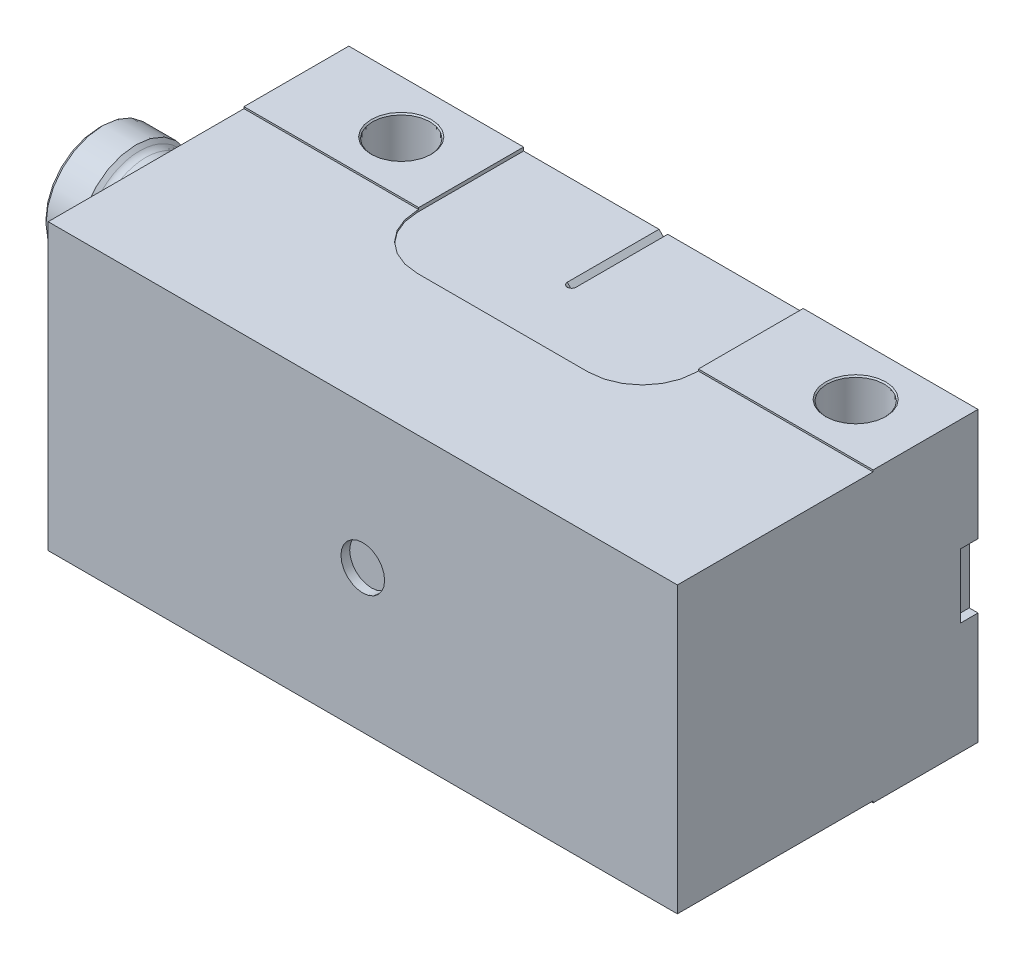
SolidWorks part; units mm, degrees
ref_plane "Front Plane" through (0, 0, 0) normal (0, 0, 1) x (1, 0, 0)
ref_plane "Top Plane" through (0, 0, 0) normal (0, 1, 0) x (1, 0, 0)
ref_plane "Right Plane" through (0, 0, 0) normal (1, 0, 0) x (0, 0, -1)
imported_body "Imported3"
sketch "Sketch1" plane through (0, 0, 6.0501) normal (0, 0, -1) x (-1, 0, 0)
  line L0 (-0.2501, 8.05) -> (-0.0001, 7.8)
  line L1 (-0.0001, 7.8) -> (0.2501, 8.05)
  line L2 (0.2501, 8.05) -> (0.2501, -8.05)
  line L3 (0.2501, -8.05) -> (0.0001, -7.8)
  line L4 (0.0001, -7.8) -> (-0.2501, -8.05)
  line L5 (-0.2501, -8.05) -> (-0.2501, 8.05)
extrude "Boss-Extrude1" add sketch "Sketch1" along normal blind 5.2501
sketch "Sketch2" plane through (0, 0, 6.3001) normal (0, 0, 1) x (1, 0, 0)
  line L0 (0.2501, -8.05) -> (-0.2501, -8.05)
  line L1 (-0.2501, -8.05) -> (-0.2501, 8.05)
  line L2 (-0.2501, 8.05) -> (0.2501, 8.05)
  line L3 (0.2501, 8.05) -> (0.2501, -8.05)
extrude "Boss-Extrude2" add sketch "Sketch2" along normal blind 0.4999
sketch "Sketch3" plane through (0.2501, 0, 0) normal (1, 0, 0) x (0, 0, -1)
  line L0 (-6.8, 8.05) -> (-0.8, 8.05)
  line L1 (-0.8, 8.05) -> (-0.8, -8.05)
  line L2 (-0.8, -8.05) -> (-6.8, -8.05)
  line L3 (-6.8, -8.05) -> (-6.8, 8.05)
extrude "Boss-Extrude3" add sketch "Sketch3" along normal blind 17.7499
sketch "Sketch4" plane through (-0.2501, 0, 0) normal (-1, 0, 0) x (0, 0, 1)
  line L0 (6.8, -8.05) -> (0.8, -8.05)
  line L1 (0.8, -8.05) -> (0.8, 8.05)
  line L2 (0.8, 8.05) -> (6.8, 8.05)
  line L3 (6.8, 8.05) -> (6.8, -8.05)
extrude "Boss-Extrude4" add sketch "Sketch4" along normal blind 17.7499
sketch "Sketch5" plane through (0, 0, 6.8) normal (0, 0, 1) x (1, 0, 0)
  line L0 (18, -8.15) -> (-18, -8.15)
  line L1 (-18, -8.15) -> (-18, 8.15)
  line L2 (-18, 8.15) -> (18, 8.15)
  line L3 (18, 8.15) -> (18, -8.15)
extrude "Boss-Extrude5" add sketch "Sketch5" along normal blind 11.2
sketch "Sketch6" plane through (0, 8.15, 0) normal (0, 1, 0) x (-1, 0, 0)
  line L0 (8, 10) -> (-8, 10)
  line L1 (-8, 10) -> (-8, 6.8)
  line L2 (-8, 6.8) -> (8, 6.8)
  line L3 (8, 6.8) -> (8, 10)
extrude "Cut-Extrude1" cut sketch "Sketch6" against normal blind 0.1
sketch "Sketch7" plane through (0, 8.05, 0) normal (0, 1, 0) x (-1, 0, 0)
  line L0 (-8, 6.8) -> (-8, 0.8)
  line L1 (-8, 0.8) -> (-18, 0.8)
  line L2 (-18, 0.8) -> (-18, 6.8)
  line L3 (-18, 6.8) -> (-8, 6.8)
extrude "Boss-Extrude6" add sketch "Sketch7" along normal blind 0.2
sketch "Sketch8" plane through (0, 8.05, 0) normal (0, 1, 0) x (-1, 0, 0)
  line L0 (18, 0.8) -> (8, 0.8)
  line L1 (8, 0.8) -> (8, 6.8)
  line L2 (8, 6.8) -> (18, 6.8)
  line L3 (18, 6.8) -> (18, 0.8)
extrude "Boss-Extrude7" add sketch "Sketch8" along normal blind 0.2
sketch "Sketch9" plane through (0, -8.15, 0) normal (0, -1, 0) x (1, 0, 0)
  line L0 (-8, 6.8) -> (8, 6.8)
  line L1 (8, 6.8) -> (8, 10)
  line L2 (8, 10) -> (-8, 10)
  line L3 (-8, 10) -> (-8, 6.8)
extrude "Cut-Extrude2" cut sketch "Sketch9" against normal blind 0.1
sketch "Sketch10" plane through (0, -8.05, 0) normal (0, -1, 0) x (1, 0, 0)
  line L0 (8, 6.8) -> (18, 6.8)
  line L1 (18, 6.8) -> (18, 0.8)
  line L2 (18, 0.8) -> (8, 0.8)
  line L3 (8, 0.8) -> (8, 6.8)
extrude "Boss-Extrude8" add sketch "Sketch10" along normal blind 0.2
sketch "Sketch11" plane through (0, -8.05, 0) normal (0, -1, 0) x (1, 0, 0)
  line L0 (-18, 6.8) -> (-8, 6.8)
  line L1 (-8, 6.8) -> (-8, 0.8)
  line L2 (-8, 0.8) -> (-18, 0.8)
  line L3 (-18, 0.8) -> (-18, 6.8)
extrude "Boss-Extrude9" add sketch "Sketch11" along normal blind 0.2
ref_plane "Plane1" through (18, 0, 0) normal (1, 0, 0) x (0, 0, -1)
ref_plane "Plane2" through (17.5, 0, 0) normal (-1, 0, 0) x (0, -1, 0)
sketch "Sketch13" plane through (17.5, 0, 0) normal (-1, 0, 0) x (0, -1, 0)
  line L0 (-1.8385, 1.8) -> (-1.8385, 0.8)
  line L1 (-1.8385, 0.8) -> (1.8385, 0.8)
  line L2 (1.8385, 0.8) -> (1.8385, 1.8)
  line L3 (1.8385, 1.8) -> (-1.8385, 1.8)
extrude "Cut-Extrude3" cut sketch "Sketch13" against normal up to surface
sketch "Sketch14" plane through (0, 0, 0.8) normal (0, 0, -1) x (-1, 0, 0)
  line L0 (18, -3) -> (18, 3)
  line L1 (17.5, 1.8385) -> (17.5, -1.8385)
  arc A0 (17.5, -1.8385) -> (18, -3) centre (19.099, -1.8385) ccw
  arc A1 (18, 3) -> (17.5, 1.8385) centre (19.099, 1.8385) ccw
extrude "Cut-Extrude4" cut sketch "Sketch14" against normal blind 1
ref_plane "Plane3" through (0, 0, 3.8) normal (0, 0, 1) x (1, 0, 0)
sketch "Sketch15" plane through (0, 0, 3.8) normal (0, 0, 1) x (1, 0, 0)
  line L0 (-10.35, 8.25) -> (-12, 8.25)
  line L1 (-12, 8.25) -> (-12, -8.25)
  line L2 (-12, -8.25) -> (-10.35, -8.25)
  line L3 (-10.35, -8.25) -> (-10.35, -4.75)
  line L4 (-10.35, -4.75) -> (-10.7, -4.5397)
  line L5 (-10.7, -4.5397) -> (-10.7, 4.5397)
  line L6 (-10.7, 4.5397) -> (-10.35, 4.75)
  line L7 (-10.35, 4.75) -> (-10.35, 8.25)
  line L8 (-12, 8.25) -> (-12, -8.25) construction
revolve "Cut-Revolve1" cut sketch "Sketch15" angle 360 about L8
sketch "Sketch16" plane through (0, 0, 3.8) normal (0, 0, 1) x (1, 0, 0)
  line L0 (15.65, 8.25) -> (14, 8.25)
  line L1 (14, 8.25) -> (14, -8.25)
  line L2 (14, -8.25) -> (15.65, -8.25)
  line L3 (15.65, -8.25) -> (15.65, -4.75)
  line L4 (15.65, -4.75) -> (15.3, -4.5397)
  line L5 (15.3, -4.5397) -> (15.3, 4.5397)
  line L6 (15.3, 4.5397) -> (15.65, 4.75)
  line L7 (15.65, 4.75) -> (15.65, 8.25)
  line L8 (14, 8.25) -> (14, -8.25) construction
revolve "Cut-Revolve2" cut sketch "Sketch16" angle 360 about L8
ref_plane "Plane4" through (0, 0, 8.625) normal (0, 0, -1) x (-1, 0, 0)
sketch "Sketch17" plane through (0, 0, 8.625) normal (0, 0, -1) x (-1, 0, 0)
  line L0 (18, 6.85) -> (18, 1.85)
  line L1 (18, 1.85) -> (24.5, 1.85)
  line L2 (24.5, 1.85) -> (24.5, 5.1)
  line L3 (24.5, 5.1) -> (22.35, 5.1)
  line L4 (22.35, 5.1) -> (22, 4.75)
  line L5 (22, 4.75) -> (20.5, 4.75)
  line L6 (20.5, 4.75) -> (20.15, 5.1)
  line L7 (20.15, 5.1) -> (19.5, 5.1)
  line L8 (19.5, 5.1) -> (19.5, 6.85)
  line L9 (19.5, 6.85) -> (18, 6.85)
  line L10 (18, 1.85) -> (24.5, 1.85) construction
revolve "Revolve1" add sketch "Sketch17" angle 360 about L10
hole_wizard "#2 Clearance Hole1" positions "Sketch19" profile "Sketch18" hole size "#2" standard "ANSI Inch"
sketch "Sketch19" plane through (0, 0, 18) normal (0, 0, 1) x (1, 0, 0)
  point P0 (0, 0)
sketch "Sketch18" plane through (0, 0, 18) normal (1, 0, 0) x (0, -1, 0)
  line L0 (0, 0) -> (0, 0.5)
  line L1 (0, 0.5) -> (1.25, 0.5)
  line L2 (1.25, 0.5) -> (1.25, 0)
  line L5 (1.25, 0) -> (0, 0)
  line L10 (0, 0.5) -> (-1.25, 0.5) construction
  line L11 (0, -6.35) -> (0, 107.95) construction
  dimension "Hole Dia." = 2.5
  dimension "Hole Depth" = 0.5
  dimension "Drill Angle" = 180
chamfer "Chamfer1" distance 0.25 angle 45 1 edges at (-24.5, 1.85, 11.875)
chamfer "Chamfer3" distance 0.075 angle 45 4 edges at (15.65, -8.25, 3.8) (-10.35, -8.25, 3.8) (-10.35, 8.25, 3.8) (15.65, 8.25, 3.8)
chamfer "Chamfer4" distance 0.5 angle 45 1 edges at (-19.5, 1.85, 13.625)
fillet "Fillet1" radius 0.25 1 edges at (-19.5, 1.85, 11.875)
fillet "Fillet2" radius 0.5 2 edges at (-20.5, 1.85, 11.525) (-22, 1.85, 11.525)
fillet "Fillet3" radius 3.1 4 edges at (-8, 8.1, 10) (8, 8.1, 10) (8, -8.1, 10) (-8, -8.1, 10)
